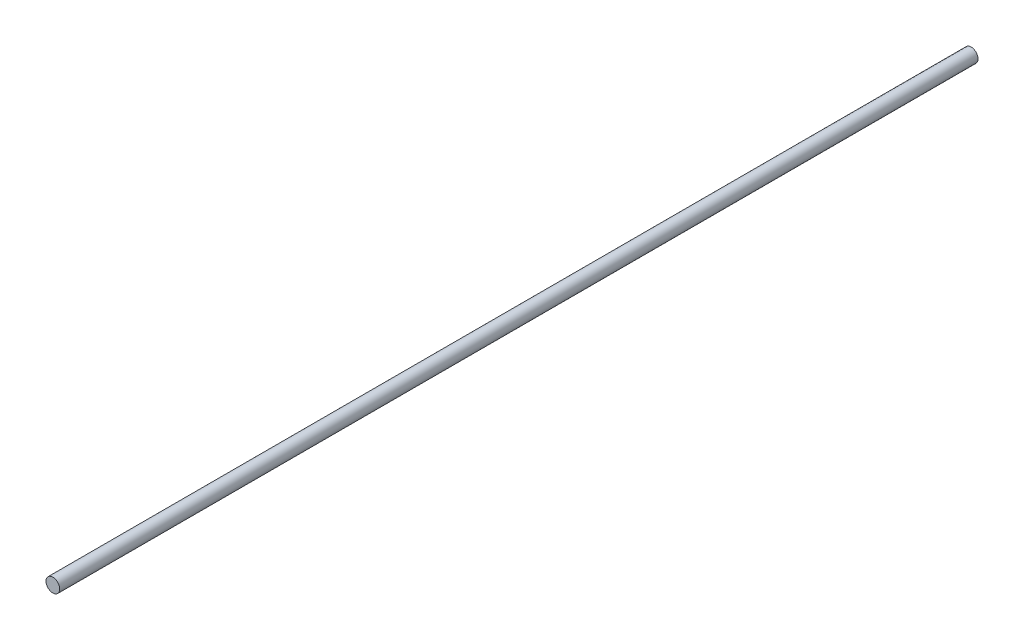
SolidWorks part; units mm, degrees
ref_plane "Alzado" through (0, 0, 0) normal (0, 0, 1) x (1, 0, 0)
ref_plane "Planta" through (0, 0, 0) normal (0, 1, 0) x (1, 0, 0)
ref_plane "Vista lateral" through (0, 0, 0) normal (1, 0, 0) x (0, 0, -1)
sketch "Croquis1" plane through (0, 0, 0) normal (0, 0, 1) x (1, 0, 0)
  circle A0 centre (0, 0) radius 1.25
  dimension "D1" = 2.5
extrude "Saliente-Extruir1" add sketch "Croquis1" along normal blind 167
